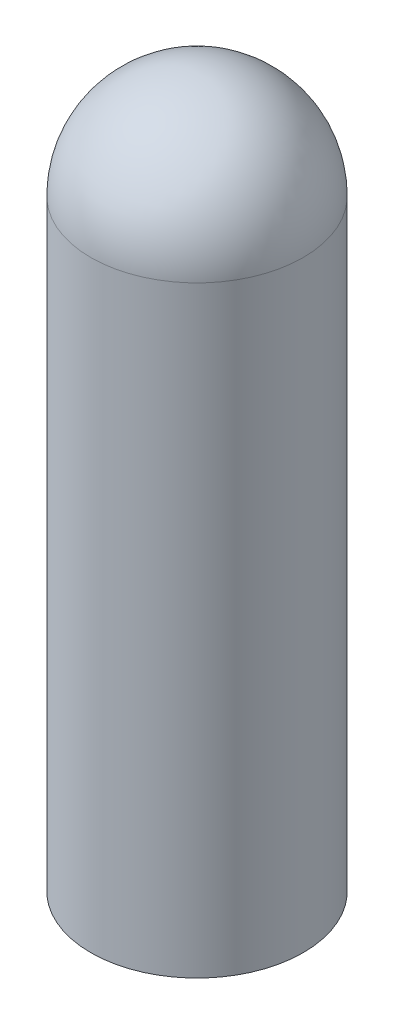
SolidWorks part; units mm, degrees
ref_plane "Front Plane" through (0, 0, 0) normal (0, 0, 1) x (1, 0, 0)
ref_plane "Top Plane" through (0, 0, 0) normal (0, 1, 0) x (1, 0, 0)
ref_plane "Right Plane" through (0, 0, 0) normal (1, 0, 0) x (0, 0, -1)
sketch "Sketch1" plane through (0, 0, 0) normal (0, 1, 0) x (1, 0, 0)
  circle A0 centre (0, 0) radius 0.762
  dimension "D1" = 1.524
extrude "Boss-Extrude1" add sketch "Sketch1" along normal blind 5.08
fillet "Fillet1" radius 0.762 1 edges at (0, 5.08, 0.762)
